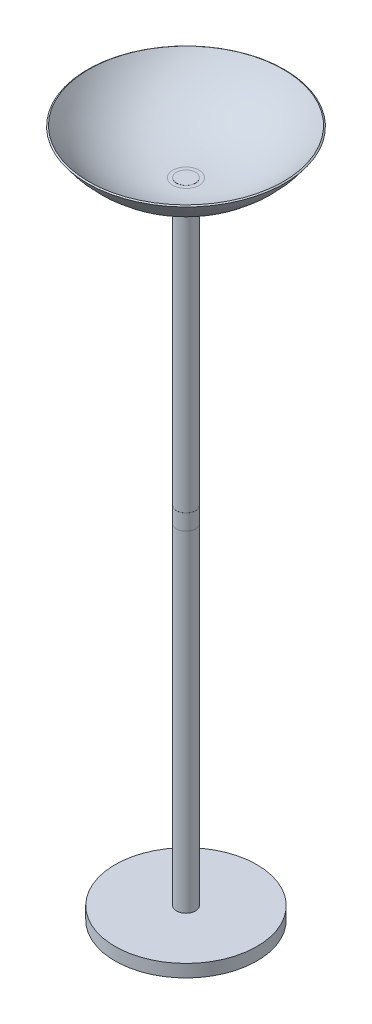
SolidWorks part; units mm, degrees
ref_plane "Front" through (0, 0, 0) normal (0, 0, 1) x (1, 0, 0)
ref_plane "Top" through (0, 0, 0) normal (0, 1, 0) x (1, 0, 0)
ref_plane "Right" through (0, 0, 0) normal (1, 0, 0) x (0, 0, -1)
sketch "Sketch1" plane through (0, 0, 0) normal (0, 1, 0) x (1, 0, 0)
  circle A0 centre (0, 0) radius 6
  dimension "D1" = 12
extrude "Base-Extrude" add sketch "Sketch1" along normal blind 180
sketch "Sketch2" plane through (0, 0, 0) normal (0, -1, 0) x (1, 0, 0)
  circle A0 centre (0, 0) radius 6.05
  dimension "D1" = 12.1
extrude "Boss-Extrude1" add sketch "Sketch2" along normal blind 10
sketch "Sketch3" plane through (0, -10, 0) normal (0, -1, 0) x (1, 0, 0)
  circle A0 centre (0, 0) radius 6
  dimension "D1" = 12
extrude "Boss-Extrude2" add sketch "Sketch3" along normal blind 210
sketch "Sketch4" plane through (0, -220, 0) normal (0, -1, 0) x (1, 0, 0)
  circle A0 centre (0, 0) radius 45
  dimension "D1" = 90
extrude "Boss-Extrude3" add sketch "Sketch4" along normal blind 8
sketch "Sketch5" plane through (0, 0, 0) normal (0, 0, 1) x (1, 0, 0)
  line L0 (0, 208.6749) -> (0, 141.679) construction
  line L1 (0, 180) -> (0, 0) construction
  line L2 (0, 179.9584) -> (8.3425, 179.9584)
  arc A0 (8.3425, 179.9584) -> (61.7405, 208.6749) centre (8.3425, 243.9632) ccw
revolve "Boss-Revolve-Thin1" add sketch "Sketch5" angle 360 about L0
scale "Scale1" scale about centroid uniform scaling yes scale factor 4
